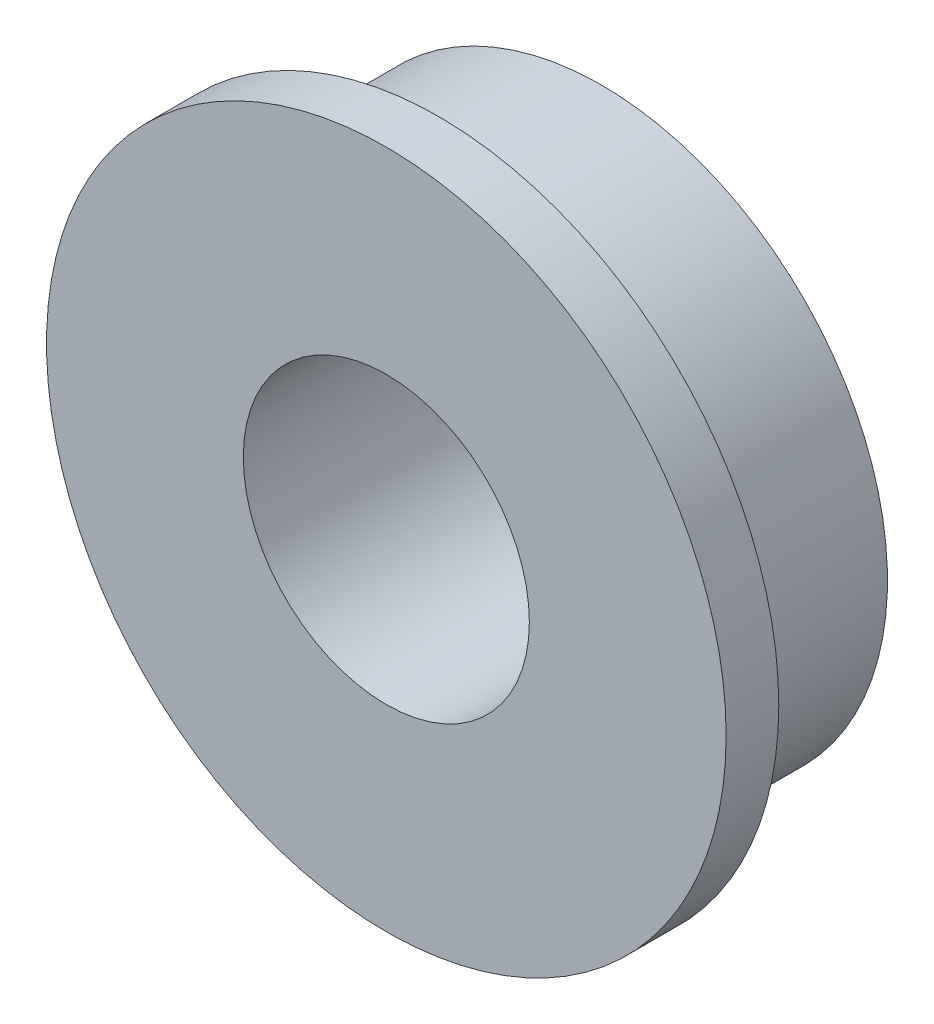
SolidWorks part; units mm, degrees
ref_plane "Front Plane" through (0, 0, 0) normal (0, 0, 1) x (1, 0, 0)
ref_plane "Top Plane" through (0, 0, 0) normal (0, 1, 0) x (1, 0, 0)
ref_plane "Right Plane" through (0, 0, 0) normal (1, 0, 0) x (0, 0, -1)
sketch "Sketch1" plane through (0, 0, 0) normal (0, 0, 1) x (1, 0, 0)
  circle A0 centre (0, 0) radius 1.5875
  circle A1 centre (0, 0) radius 3.175
  dimension "D1" = 3.175
  dimension "D2" = 6.35
extrude "Extrude1" add sketch "Sketch1" along normal blind 2.3876
sketch "Sketch2" plane through (0, 0, 2.3876) normal (0, 0, 1) x (1, 0, 0)
  circle A0 centre (0, 0) radius 3.7719
  circle A1 centre (0, 0) radius 3.175
  dimension "D1" = 7.5438
  dimension "D2" = 6.35
extrude "Extrude2" add sketch "Sketch2" against normal blind 0.5842
